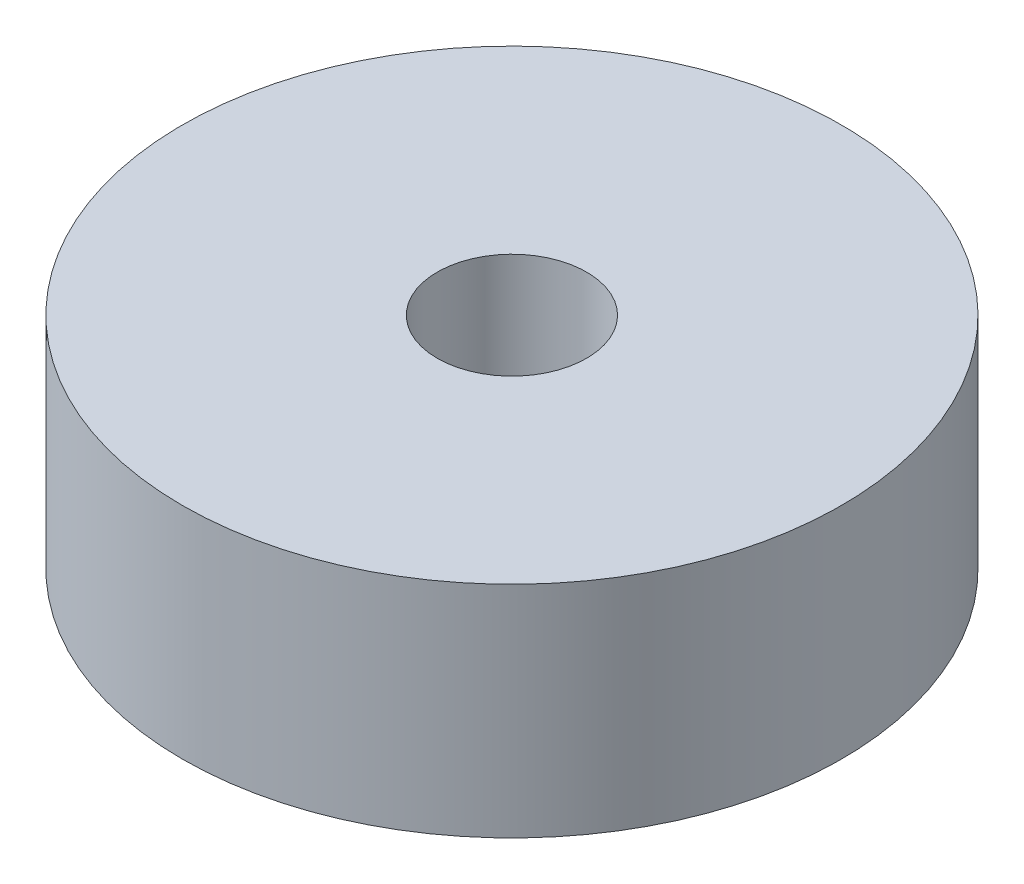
SolidWorks part; units mm, degrees
ref_plane "Plan de face" through (0, 0, 0) normal (0, 0, 1) x (1, 0, 0)
ref_plane "Plan de dessus" through (0, 0, 0) normal (0, 1, 0) x (1, 0, 0)
ref_plane "Plan de droite" through (0, 0, 0) normal (1, 0, 0) x (0, 0, -1)
sketch "Esquisse1" plane through (0, 0, 0) normal (0, 1, 0) x (1, 0, 0)
  circle A0 centre (0, 0) radius 15
  circle A1 centre (0, 0) radius 3.4
  dimension "D1" = 30
  dimension "D2" = 6.8
extrude "Extrusion1" add sketch "Esquisse1" along normal blind 10
